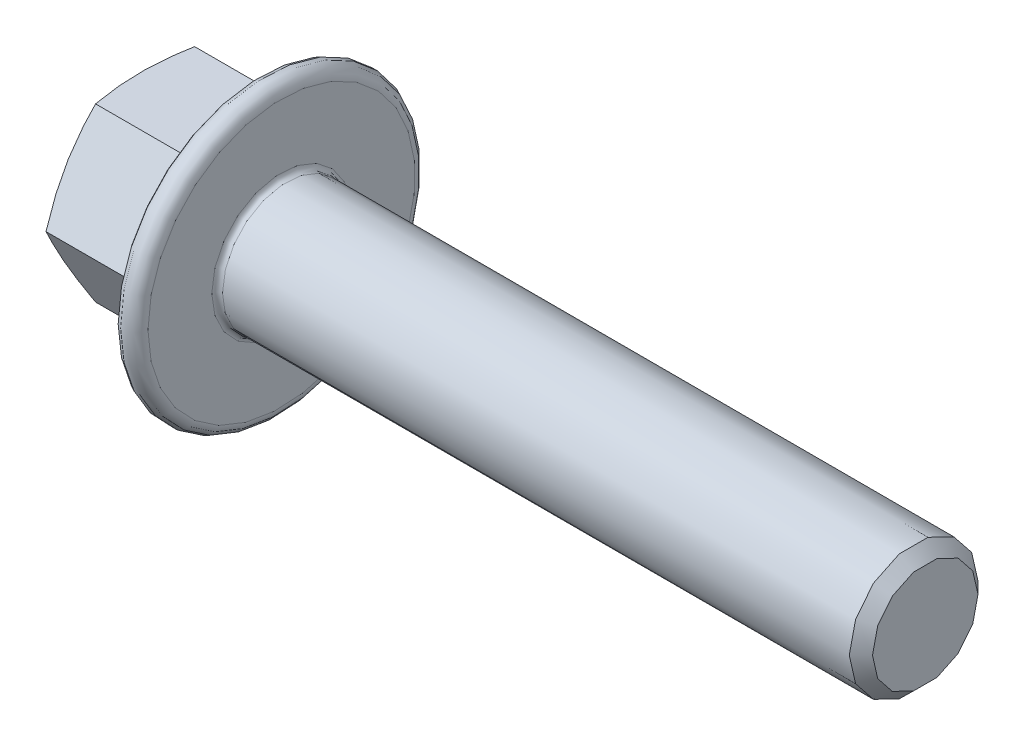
SolidWorks part; units mm, degrees
ref_plane "Front" through (0, 0, 0) normal (0, 0, 1) x (1, 0, 0)
ref_plane "Top" through (0, 0, 0) normal (0, 1, 0) x (1, 0, 0)
ref_plane "Right" through (0, 0, 0) normal (1, 0, 0) x (0, 0, -1)
sketch "Sketch1" plane through (0, 0, 0) normal (1, 0, 0) x (0, 0, -1)
  line L1 (2.3094, -4) -> (4.6188, 0)
  line L2 (4.6188, 0) -> (2.3094, 4)
  line L3 (2.3094, 4) -> (-2.3094, 4)
  line L4 (-2.3094, 4) -> (-4.6188, 0)
  line L5 (-4.6188, 0) -> (-2.3094, -4)
  line L6 (-2.3094, -4) -> (2.3094, -4)
  circle A0 centre (0, 0) radius 4 construction
  dimension "s" = 8
extrude "BaseHead" add sketch "Sketch1" along normal blind 6.8
ref_plane "Plane1" through (18.8, 0, 0) normal (1, 0, 0) x (0, 0, -1)
sketch "Sketch2" plane through (6.8, 0, 0) normal (1, 0, 0) x (0, 0, -1)
  circle A0 centre (0, 0) radius 3
  dimension "d" = 6
extrude "BaseBody" add sketch "Sketch2" along normal blind 30
sketch "Sketch3" plane through (2.5556, 0, 2.0632) normal (0, 1, 0) x (0, 0, -1)
  line L0 (6.682, 2.5556) -> (6.682, 2.112)
  line L2 (6.682, 2.112) -> (5.4632, 2.5556)
  line L4 (5.4632, 2.5556) -> (6.682, 2.5556)
  line L5 (2.0632, 3.5448) -> (2.0632, 2.0587) construction
  dimension "D1" = 20
  dimension "da" = 6.8
revolve "HeadChamfer" cut sketch "Sketch3" angle 360 about L5
sketch "Sketch5" plane through (-3.1384, 0, 9.9384) normal (0, 1, 0) x (0, 0, -1)
  line L0 (9.9384, -9.9384) -> (9.9384, -13.5308) construction
  line L1 (14.5572, -9.9384) -> (12.2478, -9.9384) construction
  line L2 (9.9384, -9.9384) -> (16.1614, -9.9384)
  line L3 (16.4052, -8.8384) -> (9.9384, -5.8229)
  line L4 (9.9384, -5.8229) -> (9.9384, -9.9384)
  line L5 (9.9384, -39.9384) -> (9.9384, -9.9384) construction
  arc A0 (16.1614, -9.9384) -> (16.4052, -8.8384) centre (16.1614, -9.3614) ccw
  dimension "D3" = 25
  dimension "c" = 1.1
  dimension "dc" = 13.6
revolve "Revolve1" add sketch "Sketch5" angle 360 about L0
fillet "HeadFillet" radius 0.25 1 edges at (6.8, 0, 3)
fillet "FlangeHexFillet" radius 0.4 6 edges at (4.6158, -1.0695, -4.0013) (4.6158, 2.9305, -2.9269) (4.6158, -2.9305, 2.9269) (4.6158, 1.0695, 4.0013)
chamfer "Chamfer1" distance 0.5415 angle 45 1 edges at (36.8, 0, -3)
equation "\"b@ThreadCosmetic1\" = \"l@BaseBody\" - \"lg@Plane1\""
equation "\"D1@Chamfer1\" = (  \"d@Sketch2\" - \"D2@ThreadCosmetic1\" )  / 2"
